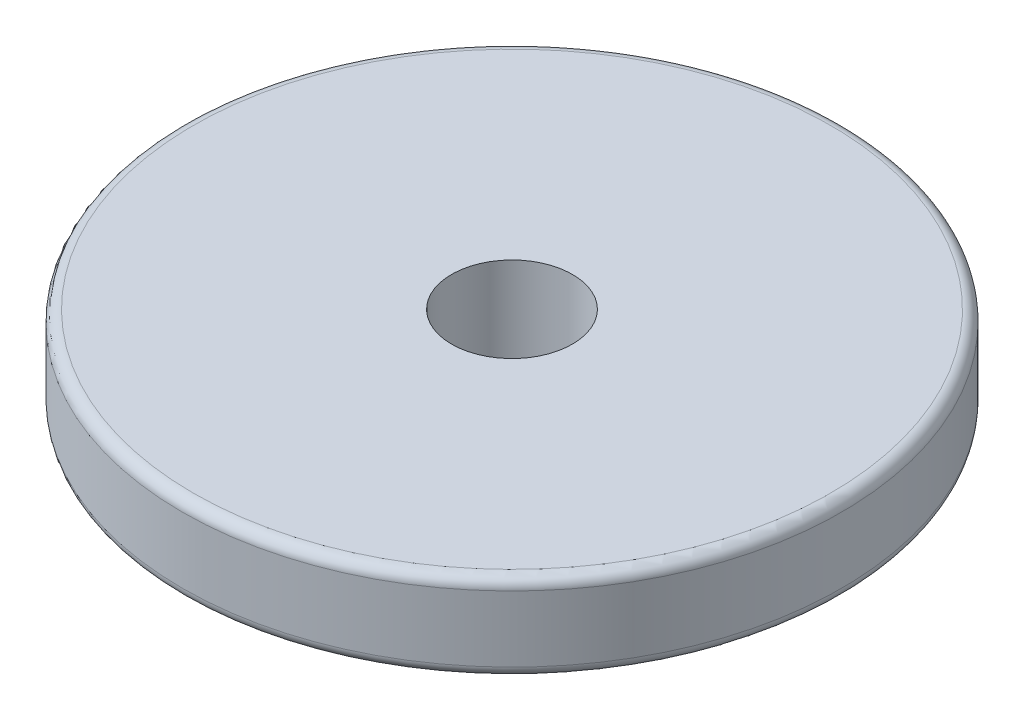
SolidWorks part; units mm, degrees
ref_plane "Front" through (0, 0, 0) normal (0, 0, 1) x (1, 0, 0)
ref_plane "Top" through (0, 0, 0) normal (0, 1, 0) x (1, 0, 0)
ref_plane "Right" through (0, 0, 0) normal (1, 0, 0) x (0, 0, -1)
sketch "Sketch1" plane through (0, 0, 0) normal (0, 1, 0) x (1, 0, 0)
  circle A0 centre (0, 0) radius 2.75
  circle A1 centre (0, 0) radius 15
  dimension "D1" = 5.5
  dimension "D2" = 30
extrude "Extrude1" add sketch "Sketch1" along normal blind 4
fillet "Fillet1" radius 0.5 2 edges at (0, 0, 15) (0, 4, 15)
